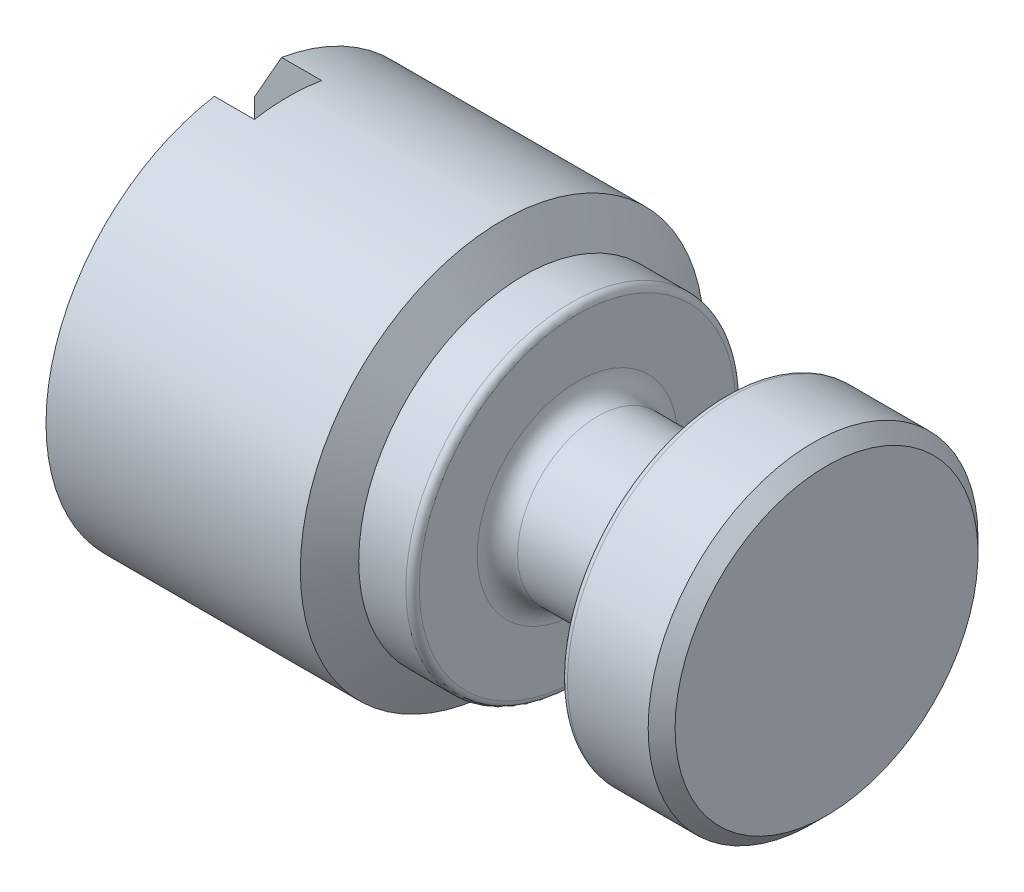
SolidWorks part; units mm, degrees
ref_plane "Plan1" through (0, 0, 0) normal (0, 0, 1) x (1, 0, 0)
ref_plane "Plan2" through (0, 0, 0) normal (0, 1, 0) x (1, 0, 0)
ref_plane "Plan3" through (0, 0, 0) normal (1, 0, 0) x (0, 0, -1)
sketch "Esquisse1" plane through (0, 0, 0) normal (0, 0, 1) x (1, 0, 0)
  line L0 (-5.455, 0) -> (26.7145, 0) construction
  line L1 (0, 2.3) -> (0, 0)
  line L2 (0, 0) -> (9, 0)
  line L3 (9, 0) -> (9, 2.45)
  line L4 (9, 2.45) -> (7.5, 2.45)
  line L5 (7.5, 2.45) -> (7.5, 1.19)
  line L6 (7.5, 1.19) -> (5.3, 1.19)
  line L7 (5.3, 1.19) -> (5.3, 2.45)
  line L8 (5.3, 2.45) -> (4.5, 2.45)
  line L9 (3.3, 0) -> (-3.3, 0) construction
  line L10 (0, -3.3) -> (0, 3.3) construction
  line L11 (4.5, 2.45) -> (4.1825, 3)
  line L12 (4.1825, 3) -> (0.4041, 3)
  line L13 (0.4041, 3) -> (0, 2.3)
  circle A0 centre (6.1, 1.9) radius 0.8 construction
  dimension "D6" = 2.2
  dimension "D7" = 1.6
  dimension "D1" = 1.26
  dimension "D2" = 4.9
  dimension "D3" = 1.5
  dimension "D4" = 2.2
  dimension "D5" = 9
  dimension "D8" = 6
  dimension "D9" = 30
  dimension "D10" = 30
  dimension "D11" = 0.7
  dimension "D12" = 0.8
  dimension "D13" = 4.5
revolve "Révolution1" add sketch "Esquisse1" angle 360 about L0
chamfer "Chanfrein1" distance 0.2 angle 45 1 edges at (9, 0, 2.45)
fillet "Congé1" radius 0.3 2 edges at (5.3, 0, 1.19) (7.5, 0, 1.19)
sketch "Esquisse2" plane through (0, 0, 0) normal (0, 0, 1) x (1, 0, 0)
  line L0 (-5.455, 0) -> (26.7145, 0) construction
  line L1 (-5.455, 0) -> (26.7145, 0) construction
  circle A0 centre (6.1, 1.9) radius 0.8 construction
  circle A1 centre (6.1, 1.9) radius 0.8
revolve "Révolution2" add sketch "Esquisse2" angle 360 about L1
sketch "Esquisse4" plane through (0, 0, 0) normal (0, 1, 0) x (1, 0, 0)
  line L1 (0, 0.5) -> (1, 0.5)
  line L2 (0, 0.5) -> (0, -0.5)
  line L3 (0, -0.5) -> (1, -0.5)
  line L4 (1, 0.5) -> (1, -0.5)
  dimension "D1" = 1
  dimension "D2" = 1
extrude "Enlèv. mat.-Extru.2" cut sketch "Esquisse4" against normal mid plane 9
delete or keep bodies "Corps-Effacer/suppr1" type delete bodies bodies 102
fillet "Congé2" radius 0.1 2 edges at (5.3, 0, 2.45) (7.5, 0, 2.45)
